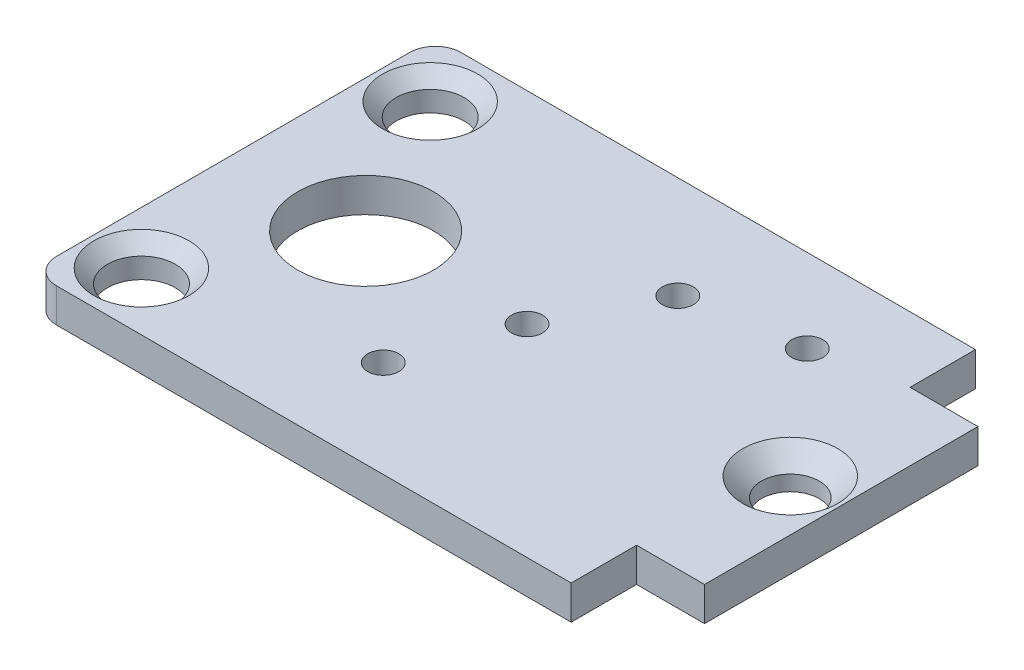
SolidWorks part; units mm, degrees
ref_plane "Front Plane" through (0, 0, 0) normal (0, 0, 1) x (1, 0, 0)
ref_plane "Top Plane" through (0, 0, 0) normal (0, 1, 0) x (1, 0, 0)
ref_plane "Right Plane" through (0, 0, 0) normal (1, 0, 0) x (0, 0, -1)
sketch "Sketch1" plane through (0, 0, 0) normal (0, 1, 0) x (1, 0, 0)
  line L1 (12, 5.95) -> (-3.9, 5.95)
  line L2 (14, 4.025) -> (14, -4.025)
  line L3 (12, -5.95) -> (-3.9, -5.95)
  line L4 (-3.9, 5.95) -> (-3.9, -5.95)
  line L5 (-0.55, 0) -> (0.55, 0) construction
  line L6 (12, 5.95) -> (12, 4.025)
  line L7 (0, -0.55) -> (0, 0.55) construction
  line L8 (12, 4.025) -> (14, 4.025)
  line L9 (12, -5.95) -> (12, -4.025)
  line L10 (12, -4.025) -> (14, -4.025)
  circle A0 centre (0, 0) radius 2
  point P0 (14, 0)
  point P2 (-3.9, 0)
  dimension "D4" = 4
  dimension "D6" = 2
  dimension "D1" = 14
  dimension "D2" = 17.9
  dimension "D3" = 11.9
  dimension "D5" = 8.05
extrude "Boss-Extrude1" add sketch "Sketch1" along normal blind 1
sketch "Sketch2" plane through (0, 1, 0) normal (0, 1, 0) x (1, 0, 0)
  line L0 (-2.35, 4.25) -> (-2.35, -4.25) construction
  line L1 (-0.55, 0) -> (0.55, 0) construction
  line L3 (14, -4.025) -> (14, 4.025) construction
  circle A0 centre (-2.35, 4.25) radius 1
  circle A1 centre (-2.35, -4.25) radius 1
  point P2 (-2.35, 0)
  dimension "D3" = 2
  dimension "D1" = 8.5
  dimension "D2" = 16.35
extrude "Cut-Extrude1" cut sketch "Sketch2" against normal through all
fillet "Fillet1" radius 0.75 2 edges at (-3.9, 0.5, -5.95) (-3.9, 0.5, 5.95)
chamfer "Chamfer1" distance 0.4 angle 45 2 edges at (-2.35, 1, 5.25) (-2.35, 1, -3.25)
sketch "Sketch3" plane through (0, 1, 0) normal (0, 1, 0) x (1, 0, 0)
  line L0 (-0.55, 0) -> (0.55, 0) construction
  line L1 (14, -4.025) -> (14, 4.025) construction
  circle A0 centre (3.6186, -3.1) radius 0.4572
  circle A1 centre (4.75, 0) radius 0.4572
  circle A2 centre (6.2478, 2.9405) radius 0.4572
  circle A3 centre (9.5, 3.5) radius 0.4572
  arc A5 (6.856, 1.5254) -> (6.3481, 4.4776) centre (9.5, 3.5) cw construction
  arc A6 (3.5785, 1.0001) -> (6.2478, -0.3595) centre (6.2478, 2.9405) ccw construction
  arc A7 (5.1489, -3.2758) -> (2.3349, -2.2488) centre (4.75, 0) cw construction
  point P19 (4.75, 0)
  point P22 (3.6186, -3.1)
  point P23 (6.2478, 2.9405)
  dimension "D1" = 0.9144
  dimension "D4" = 3.3
  dimension "D9" = 3.3
  dimension "D10" = 3.3
  dimension "D2" = 3.1
  dimension "D3" = 4.75
  dimension "D5" = 4.5
  dimension "D6" = 7.7522
  dimension "D7" = 10.3814
  dimension "D8" = 3.5
extrude "Cut-Extrude2" cut sketch "Sketch3" against normal through all
hole_wizard "CSK for M1.6 Countersunk Raised Head Screw2" positions "Sketch4" profile "Sketch5" countersink size "M1.6" standard "DIN"
sketch "Sketch4" plane through (0, 1, 0) normal (0, 1, 0) x (1, 0, 0)
  line L0 (-0.55, 0) -> (0.55, 0) construction
  line L1 (14, -4.025) -> (14, 4.025) construction
  point P0 (12.5, 0)
  dimension "D1" = 1.5
sketch "Sketch5" plane through (12.5, 1, 0) normal (1, 0, 0) x (0, 0, 1)
  line L0 (0, 0) -> (0, 1)
  line L1 (0, 1) -> (0.85, 1)
  line L2 (0.85, 1) -> (0.85, 0.55)
  line L3 (0.85, 0.55) -> (1.4, 0)
  line L5 (1.4, 0) -> (0, 0)
  line L6 (-0.85, 0.55) -> (-1.4, 0) construction
  line L11 (0, -6.35) -> (0, 107.95) construction
  dimension "Thru Hole Dia." = 1.7
  dimension "Thru Hole Depth" = 1
  dimension "Near C'Sink Dia." = 2.8
  dimension "Near C'Sink Angle" = 90
